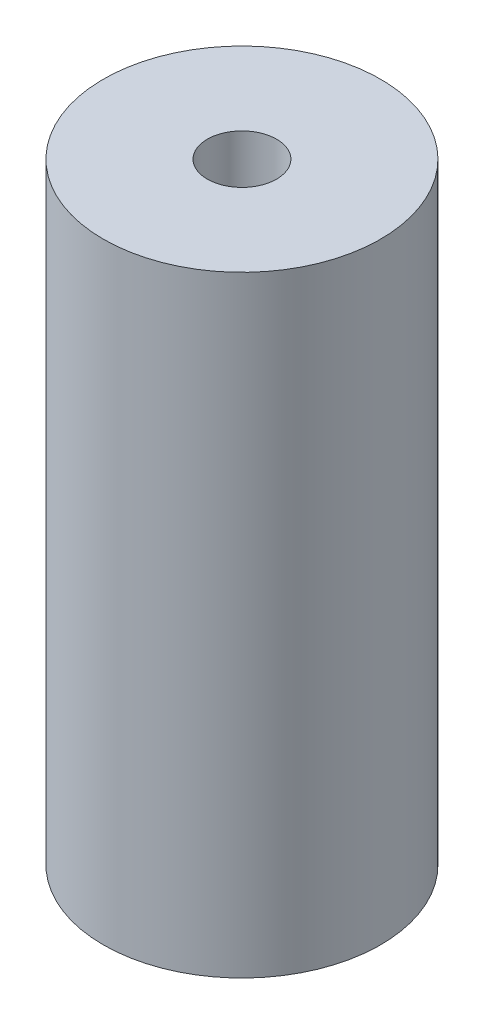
SolidWorks part; units mm, degrees
ref_plane "Front" through (0, 0, 0) normal (0, 0, 1) x (1, 0, 0)
ref_plane "Top" through (0, 0, 0) normal (0, 1, 0) x (1, 0, 0)
ref_plane "Right" through (0, 0, 0) normal (1, 0, 0) x (0, 0, -1)
ref_axis "Axis1" through (0, -50, 0) along (0, 1, 0)
sketch "Sketch4" plane through (0, 0, 0) normal (0, 1, 0) x (1, 0, 0)
  circle A0 centre (0, 0) radius 6.35
  circle A1 centre (0, 0) radius 1.5875
  dimension "D1" = 12.7
  dimension "D2" = 3.175
sketch "Sketch5" plane through (0, 0, 0) normal (0, 1, 0) x (1, 0, 0)
  circle A5 centre (0, 0) radius 6.35
  circle A6 centre (0, 0) radius 6.35
  dimension "D2" = 0
extrude "Boss-Extrude1" add sketch "Sketch5" along normal mid plane 28
hole_wizard "1/8 (0.125) Diameter Hole1" positions "Sketch10" profile "Sketch11" hole size "1/8" standard "ANSI Inch"
sketch "Sketch10" plane through (0, 14, 0) normal (0, 1, 0) x (1, 0, 0)
  point P0 (0, 0)
sketch "Sketch11" plane through (0, 14, 0) normal (1, 0, 0) x (0, 0, 1)
  line L0 (0, 0) -> (0, 28.9529)
  line L1 (0, 28.9529) -> (1.5875, 27.999)
  line L2 (1.5875, 27.999) -> (1.5875, 0)
  line L5 (1.5875, 0) -> (0, 0)
  line L10 (0, 28.9529) -> (-1.5875, 27.999) construction
  line L11 (0, -6.35) -> (0, 107.95) construction
  dimension "Hole Dia." = 3.175
  dimension "Hole Depth" = 27.999
  dimension "Drill Angle" = 118
sketch "Sketch8" [suppressed] plane through (0, 0, 0) normal (1, 0, 0) x (0, 0, -1)
  line L0 (6.35, 10.25) -> (-6.35, 10.25) construction
  line L1 (-2.6797, 10.25) -> (-4.8133, 10.25) construction
  line L2 (-2.6797, 10.25) -> (-2.6797, 8.9292) construction
  line L3 (-2.6797, 8.9292) -> (-4.8133, 8.9292) construction
  line L4 (-4.8133, 10.25) -> (-4.8133, 8.9292) construction
  line L5 (-2.6797, 10.25) -> (-4.8133, 8.9292) construction
  line L6 (-2.6797, 8.9292) -> (-4.8133, 10.25) construction
  line L7 (-6.35, -10.25) -> (6.35, -10.25) construction
  line L8 (-2.6797, -10.25) -> (-4.8133, -10.25)
  line L9 (-2.6797, -10.25) -> (-2.6797, -8.9292)
  line L10 (-2.6797, -8.9292) -> (-4.8133, -8.9292)
  line L11 (-4.8133, -10.25) -> (-4.8133, -8.9292)
  line L12 (-2.6797, -10.25) -> (-4.8133, -8.9292) construction
  line L13 (-2.6797, -8.9292) -> (-4.8133, -10.25) construction
  point P4 (-3.7465, 9.5896)
  point P11 (-3.7465, -9.5896)
  dimension "D1" = 2.1336
  dimension "D2" = 4.8133
  dimension "D3" = 1.3208
sketch "Sketch9" [suppressed] plane through (0, 0, 0) normal (1, 0, 0) x (0, 0, -1)
  line L0 (-2.6797, 10.25) -> (-2.6797, 8.9292) construction
  line L1 (-2.6797, 10.25) -> (-4.8133, 10.25) construction
  line L2 (-4.8133, 10.25) -> (-4.8133, 8.9292) construction
  line L3 (-2.6797, 8.9292) -> (-4.8133, 8.9292) construction
  line L4 (-4.8133, -10.25) -> (-2.6797, -10.25)
  line L5 (-4.8133, -8.9292) -> (-4.8133, -10.25)
  line L6 (-2.6797, -8.9292) -> (-4.8133, -8.9292)
  line L7 (-2.6797, -10.25) -> (-2.6797, -8.9292)
  line L12 (-4.8133, -10.25) -> (-2.6797, -10.25)
  line L14 (-4.8133, -8.9292) -> (-4.8133, -10.25)
  line L20 (-2.6797, -8.9292) -> (-4.8133, -8.9292)
  line L22 (-2.6797, -10.25) -> (-2.6797, -8.9292)
  line L23 (-2.6797, 10.25) -> (-2.6797, 8.9292)
  line L24 (-2.6797, 10.25) -> (-4.8133, 10.25)
  line L25 (-4.8133, 10.25) -> (-4.8133, 8.9292)
  line L26 (-2.6797, 8.9292) -> (-4.8133, 8.9292)
  dimension "D1" = 0
revolve "-010 o-ring groove" [suppressed] cut sketch "Sketch9" angle 360 about axis through (0, -50, 0) along (0, 1, 0)
sketch "Sketch12" plane through (0, 0, 0) normal (1, 0, 0) x (0, 0, -1)
  line L0 (-6.35, -14) -> (6.35, -14) construction
  line L1 (-3.2258, -14) -> (-1.0922, -14) construction
  line L2 (-3.2258, -14) -> (-3.2258, -12.6792) construction
  line L3 (-3.2258, -12.6792) -> (-1.0922, -12.6792) construction
  line L4 (-1.0922, -14) -> (-1.0922, -12.6792) construction
  line L5 (-3.2258, -14) -> (-1.0922, -12.6792) construction
  line L6 (-3.2258, -12.6792) -> (-1.0922, -14) construction
  line L7 (0, -50) -> (0, 50) construction
  line L8 (-1.5875, -11.6) -> (-3.9875, -14)
  line L9 (-3.9875, -14) -> (-1.5875, -14)
  line L10 (-1.5875, -14) -> (-1.5875, -11.6)
  line L11 (-1.5875, -14) -> (-2.7875, -12.8) construction
  circle A0 centre (-2.4765, -13.7462) radius 0.889 construction
  point P4 (-2.159, -13.3396)
  point P15 (-2.7875, -12.8)
  dimension "D6" = 1.778
  dimension "D1" = 3.2258
  dimension "D2" = 2.1336
  dimension "D3" = 1.3208
  dimension "D4" = 1.5875
  dimension "D5" = 45
  dimension "D7" = 2.4
sketch "Sketch13" plane through (0, 0, 0) normal (1, 0, 0) x (0, 0, -1)
  line L3 (-1.5875, -11.6) -> (-3.9875, -14)
  line L4 (-3.9875, -14) -> (-1.5875, -14)
  line L5 (-1.5875, -14) -> (-1.5875, -11.6)
  line L6 (-1.5875, -11.6) -> (-3.9875, -14)
  line L7 (-3.9875, -14) -> (-1.5875, -14)
  line L8 (-1.5875, -14) -> (-1.5875, -11.6)
  dimension "D1" = 0
revolve "Cut-Revolve1" cut sketch "Sketch13" angle 360 about axis through (0, -50, 0) along (0, 1, 0)
